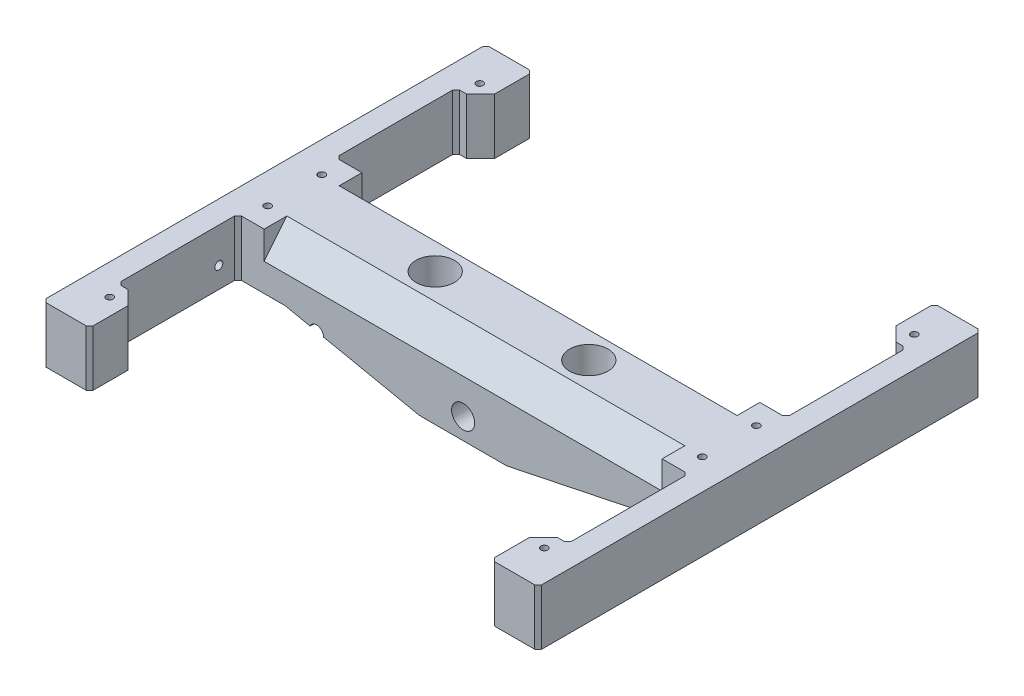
SolidWorks part; units mm, degrees
ref_plane "Plan de face" through (0, 0, 0) normal (0, 0, 1) x (1, 0, 0)
ref_plane "Plan de dessus" through (0, 0, 0) normal (0, 1, 0) x (1, 0, 0)
ref_plane "Plan de droite" through (0, 0, 0) normal (1, 0, 0) x (0, 0, -1)
sketch "Esquisse1" plane through (0, 0, 0) normal (0, 1, 0) x (1, 0, 0)
  line L0 (-71, 63.5) -> (-71, 0)
  line L2 (-71, 0) -> (71, 0)
  line L3 (71, 63.5) -> (71, 0)
  line L6 (-64.5, 14) -> (64.5, 14)
  line L7 (57.5, 63.5) -> (57.5, 52.5)
  line L8 (57.5, 63.5) -> (71, 63.5)
  line L11 (64.5, 14) -> (64.5, 48.5)
  line L12 (61.5, 48.5) -> (64.5, 48.5)
  line L13 (-65, 63.5) -> (65, 63.5) construction
  line L14 (65, 63.5) -> (65, 5) construction
  line L15 (65, 5) -> (-65, 5) construction
  line L16 (-65, 5) -> (-65, 63.5) construction
  line L17 (57.5, 52.5) -> (61.5, 48.5)
  line L18 (0, 0) -> (0, 14) construction
  line L19 (-64.5, 14) -> (-64.5, 48.5)
  line L20 (-61.5, 48.5) -> (-64.5, 48.5)
  line L21 (-57.5, 52.5) -> (-61.5, 48.5)
  line L22 (-57.5, 63.5) -> (-71, 63.5)
  line L23 (-57.5, 63.5) -> (-57.5, 52.5)
  point P13 (57.5, 48.5)
  point P18 (0, 5)
  dimension "D1" = 58.5
  dimension "D2" = 130
  dimension "D3" = 5
  dimension "D4" = 13.5
  dimension "D5" = 6
  dimension "D6" = 15
  dimension "D7" = 0.5
  dimension "D8" = 7
  dimension "D9" = 14
extrude "Boss.-Extru.1" add sketch "Esquisse1" against normal blind 24
sketch "Esquisse2" plane through (0, 0, 0) normal (0, 0, 1) x (1, 0, 0)
  line L0 (-71, -16) -> (-51, -16)
  line L1 (-71, -24) -> (-71, 0) construction
  line L2 (-51, -16) -> (-12.5, -24)
  line L3 (-71, -24) -> (71, -24) construction
  line L4 (-12.5, -24) -> (12.5, -24)
  line L5 (12.5, -24) -> (51, -16)
  line L6 (51, -16) -> (71, -16)
  line L7 (71, -24) -> (71, 0) construction
  line L8 (71, -16) -> (71, -45.3681)
  line L9 (71, -45.3681) -> (-71, -45.3681)
  line L10 (-71, -45.3681) -> (-71, -16)
  circle A0 centre (0, -18) radius 3.3
  point P4 (0, -24)
  point P15 (0, 0)
  dimension "D4" = 6.6
  dimension "D1" = 25
  dimension "D2" = 20
  dimension "D3" = 8
  dimension "D5" = 6
extrude "Enlèv. mat.-Extru.1" cut sketch "Esquisse2" against normal through all
mirror "Symétrie1" about plane through (0, 0, 0) normal (0, 0, 1) of "Enlèv. mat.-Extru.1", "Boss.-Extru.1"
sketch "Esquisse4" plane through (0, 0, 0) normal (0, 0, 1) x (1, 0, 0)
  line L0 (-31.75, -20) -> (-8, -8)
  line L1 (-12.5, -24) -> (-51, -16) construction
  line L2 (-8, -8) -> (8, -8)
  line L3 (8, -8) -> (31.75, -20)
  line L4 (51, -16) -> (12.5, -24) construction
  line L5 (31.75, -20) -> (12.5, -24)
  line L6 (12.5, -24) -> (-12.5, -24)
  line L7 (-12.5, -24) -> (-31.75, -20)
  dimension "D1" = 16
  dimension "D2" = 16
extrude "Enlèv. mat.-Extru.2" cut sketch "Esquisse4" against normal mid plane 15
sketch "Esquisse5" plane through (0, 0, 0) normal (0, 1, 0) x (1, 0, 0)
  line L0 (-22, 0) -> (22, 0) construction
  circle A0 centre (-22, 0) radius 5.5
  circle A1 centre (22, 0) radius 5.5
  dimension "D2" = 11
  dimension "D1" = 44
extrude "Enlèv. mat.-Extru.3" cut sketch "Esquisse5" against normal through all
sketch "Esquisse6" plane through (0, 0, 0) normal (0, 1, 0) x (1, 0, 0)
  circle A0 centre (-62.25, 53) radius 1
  circle A1 centre (-62.25, 7.75) radius 1
  circle A2 centre (-62.25, -7.75) radius 1
  circle A3 centre (-62.25, -53) radius 1
  circle A4 centre (62.25, -53) radius 1
  circle A5 centre (62.25, -7.75) radius 1
  circle A6 centre (62.25, 7.75) radius 1
  circle A7 centre (62.25, 53) radius 1
  dimension "D1" = 2
extrude "Enlèv. mat.-Extru.4" cut sketch "Esquisse6" against normal blind 5
sketch "Esquisse7" plane through (0, 0, -14) normal (0, 0, -1) x (-1, 0, 0)
  line L0 (-31.75, -20) -> (-22.1143, -22.0022)
  line L1 (-12.5, -24) -> (-51, -16) construction
  line L2 (-22.1143, -22.0022) -> (-23.3101, -27.7567)
  line L3 (-23.3101, -27.7567) -> (-32.9457, -25.7545)
  line L4 (-32.9457, -25.7545) -> (-31.75, -20)
extrude "Boss.-Extru.2" add sketch "Esquisse7" against normal up to surface (6.5 mm away)
sketch "Esquisse8" plane through (16.8163, 3.4943, 0) normal (-0.9791, -0.2034, 0) x (0, 0, 1)
  circle A0 centre (-10.2797, -29.4273) radius 1.25
  point P2 (-10.2797, -29.4273)
  dimension "D1" = 2.5
extrude "Enlèv. mat.-Extru.5" cut sketch "Esquisse8" against normal up to next
fillet "Congé1" radius 2 2 edges at (28.1279, -26.7556, -7.5) (28.1279, -26.7556, -14)
fillet "Congé2" radius 2 6 edges at (-22.125, -22, 7.5) (0, -24, 7.5) (22.125, -22, 7.5) (-22.125, -22, -7.5) (17.3072, -23.0011, -7.5) (0, -24, -7.5)
chamfer "Chanfrein2" distance 1 angle 45 16 edges at (-71, -8, 63.5) (-57.5, -8, 63.5) (57.5, -8, 63.5) (71, -8, 63.5) (64.5, -8, 48.5) (64.5, -8, 14) (-64.5, -8, 14) (-64.5, -8, 48.5) (-71, -8, -63.5) (71, -8, -63.5) (57.5, -8, -63.5) (64.5, -8, -48.5) (64.5, -8, -14) (-64.5, -8, -14) (-64.5, -8, -48.5) (-57.5, -8, -63.5)
sketch "Esquisse10" plane through (0, 0, 0) normal (1, 0, 0) x (0, 0, -1)
  line L0 (-7.5, 0) -> (-14, -8)
  line L1 (62.5, 0) -> (-62.5, 0) construction
  line L2 (-14, 0) -> (-14, -16) construction
  line L3 (-14, -8) -> (-14, 0)
  line L4 (-14, 0) -> (-7.5, 0)
  line L5 (14, 0) -> (14, -8)
  line L6 (14, -16) -> (14, 0) construction
  line L7 (14, -8) -> (7.5, 0)
  line L8 (7.5, 0) -> (14, 0)
  line L9 (-63.5, -16) -> (-63.5, 0) construction
  dimension "D1" = 56
extrude "Enlèv. mat.-Extru.6" cut sketch "Esquisse10" against normal mid plane 114
sketch "Esquisse11" plane through (0, 0, -14) normal (0, 0, -1) x (-1, 0, 0)
  circle A0 centre (42, -18.2615) radius 2
  dimension "D1" = 4
  dimension "D2" = 9
extrude "Enlèv. mat.-Extru.7" cut sketch "Esquisse11" against normal up to next
sketch "Esquisse12" plane through (-5.298, -25.4965, 0) normal (-0.2034, -0.9791, 0) x (0.9791, -0.2034, 0)
  circle A0 centre (-32.6434, 10.5) radius 1.1
  circle A1 centre (-42.2434, -10.5) radius 1.1
  dimension "D1" = 2.2
  dimension "D2" = 2.2
extrude "Enlèv. mat.-Extru.8" cut sketch "Esquisse12" against normal blind 10
sketch "Esquisse13" plane through (-71, 0, 0) normal (-1, 0, 0) x (0, 0, 1)
  line L0 (-62.5, -16) -> (62.5, -16) construction
  line L1 (0, 0) -> (0, -16) construction
  line L2 (-62.5, 0) -> (62.5, 0) construction
  circle A0 centre (19.5, -10) radius 1.15
  circle A1 centre (-19.5, -10) radius 1.15
  ellipse E0 centre (19.5, -8.7248) end of major axis (18.35, -8.7248) minor radius 1.15 construction
  ellipse E1 centre (19.5, -8.7248) end of major axis (18.35, -8.7248) minor radius 1.15 construction
  dimension "D1" = 2.3
  dimension "D2" = 6
  dimension "D3" = 44
extrude "Enlèv. mat.-Extru.9" cut sketch "Esquisse13" against normal up to next
